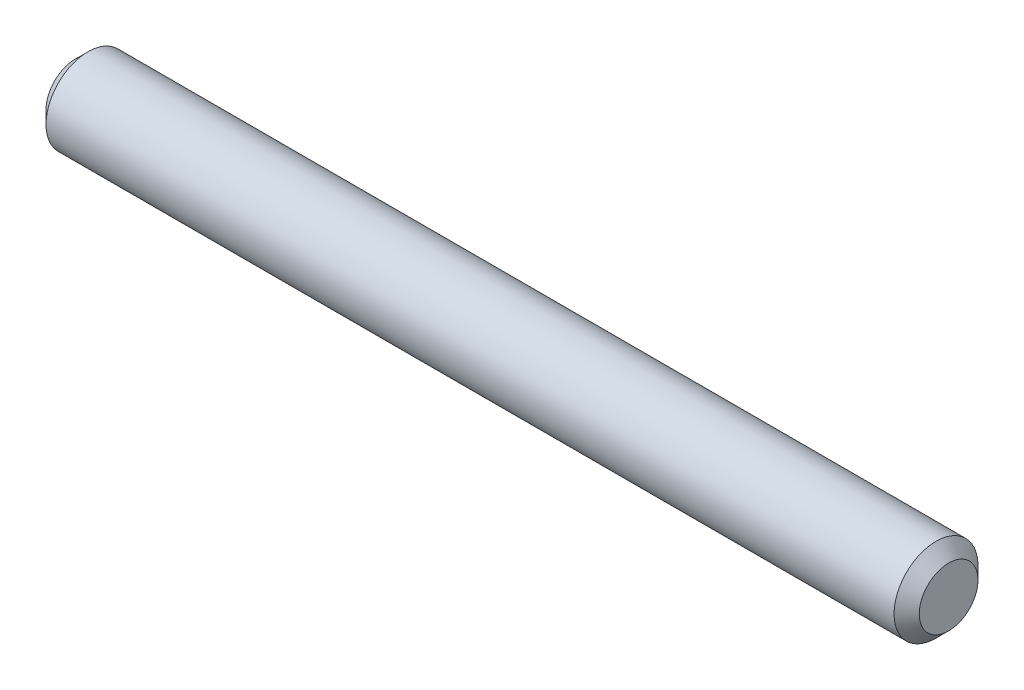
SolidWorks part; units mm, degrees
ref_plane "Front Plane" through (0, 0, 0) normal (0, 0, 1) x (1, 0, 0)
ref_plane "Top Plane" through (0, 0, 0) normal (0, 1, 0) x (1, 0, 0)
ref_plane "Right Plane" through (0, 0, 0) normal (1, 0, 0) x (0, 0, -1)
ref_plane "Plane1" through (0, 0, 0) normal (0, 0, -1) x (-1, 0, 0)
sketch "Sketch1" plane through (0, 0, 0) normal (0, 0, -1) x (-1, 0, 0)
  line L0 (-10.4, 0.7) -> (-10.4, 0)
  line L1 (-10.4, 0) -> (10.4, 0)
  line L2 (10.4, 0) -> (10.4, 0.7)
  line L3 (10.4, 0.7) -> (10.1, 1)
  line L4 (10.1, 1) -> (-10.1, 1)
  line L5 (-10.1, 1) -> (-10.4, 0.7)
  line L6 (-10.4, 0) -> (10.4, 0) construction
revolve "Revolve1" add sketch "Sketch1" angle 360 about L6
